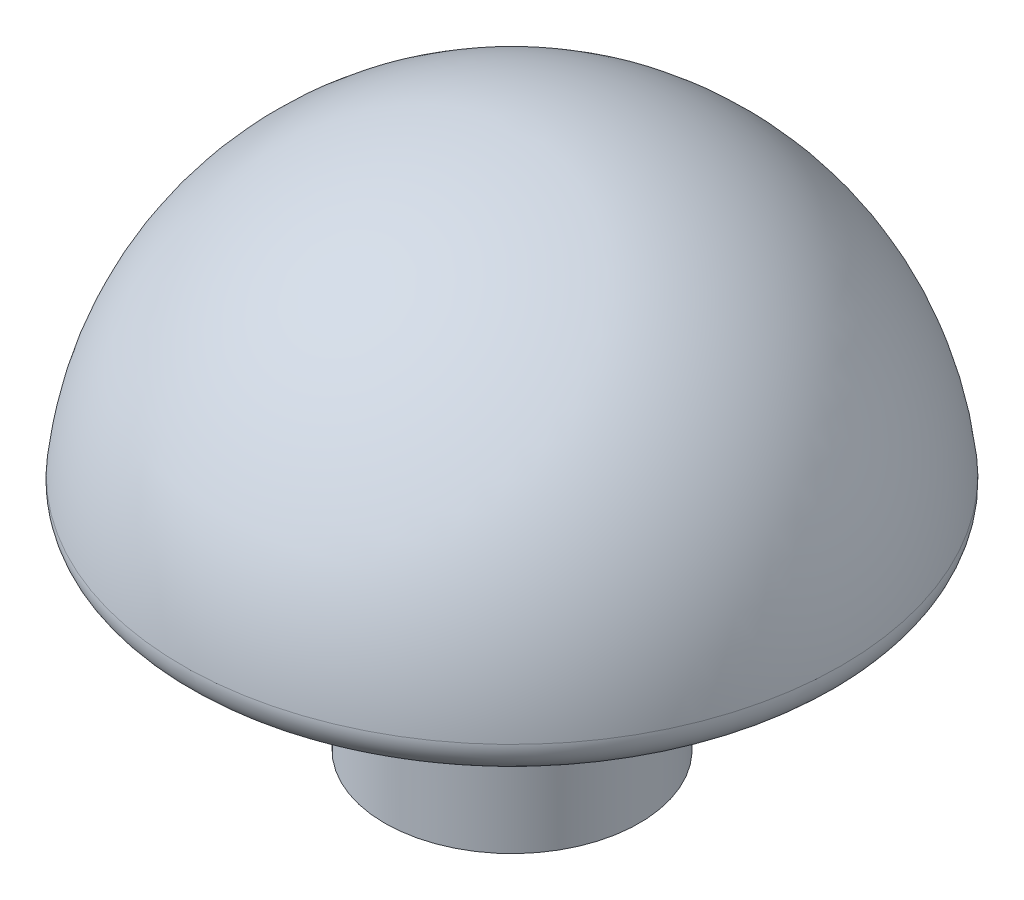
SolidWorks part; units mm, degrees
ref_plane "Front" through (0, 0, 0) normal (0, 0, 1) x (1, 0, 0)
ref_plane "Top" through (0, 0, 0) normal (0, 1, 0) x (1, 0, 0)
ref_plane "Right" through (0, 0, 0) normal (1, 0, 0) x (0, 0, -1)
sketch "Sketch1" plane through (0, 0, 0) normal (0, 1, 0) x (1, 0, 0)
  line L0 (4.5, 6) -> (4.5, -6)
  arc A0 (4.5, 6) -> (4.5, -6) centre (0, 0) ccw
  circle A1 centre (0, 0) radius 12.5
  dimension "D1" = 15
  dimension "D2" = 25
  dimension "D3" = 12
extrude "Extrude1" add sketch "Sketch1" along normal blind 20
sketch "Sketch3" plane through (0, 0, 0) normal (0, 0, 1) x (1, 0, 0)
  line L0 (12.5, 20) -> (-12.5, 20) construction
  line L1 (32.5, 20) -> (0, 20)
  line L2 (0, 20) -> (0, 52.5)
  arc A0 (32.5, 20) -> (0, 52.5) centre (0, 20) ccw
  dimension "D1" = 65
revolve "Revolve1" add sketch "Sketch3" angle 360 about L2
fillet "Fillet2" radius 3 2 edges at (0, 20, -32.5) (0, 20, 12.5)
